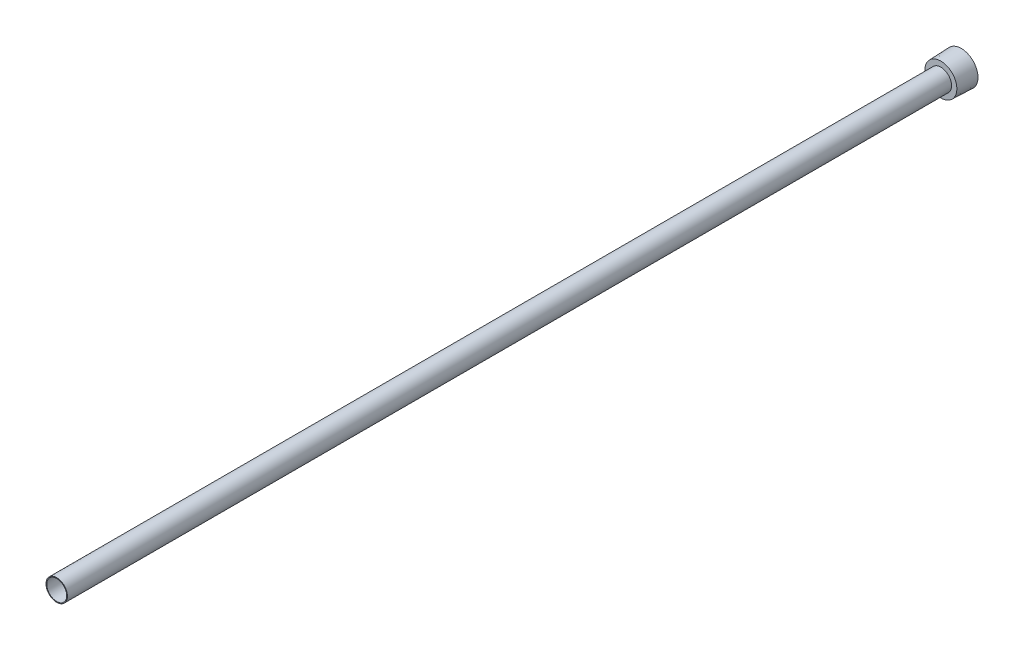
SolidWorks part; units mm, degrees
ref_plane "Front Plane" through (0, 0, 0) normal (0, 0, 1) x (1, 0, 0)
ref_plane "Top Plane" through (0, 0, 0) normal (0, 1, 0) x (1, 0, 0)
ref_plane "Right Plane" through (0, 0, 0) normal (1, 0, 0) x (0, 0, -1)
sketch "Sketch1" plane through (0, 0, 0) normal (1, 0, 0) x (0, 0, -1)
  line L0 (-168.7934, 0) -> (49831.2066, 0) construction
  line L6 (0, 0) -> (0, 8.4709)
  line L7 (0, 8.4709) -> (-10.3124, 8.0947)
  line L8 (-10.3124, 8.0947) -> (-10.3124, 5.4229)
  line L9 (-10.3124, 5.4229) -> (-457.2, 5.4229)
  line L10 (-457.2, 5.4229) -> (-457.2, 0)
  line L11 (0, 0) -> (-457.2, 0)
  dimension "D1" = 10.3124
  dimension "D2" = 16.9418
  dimension "D3" = 2.089
  dimension "D4" = 10.8458
  dimension "D5" = 457.2
revolve "Revolve1" add sketch "Sketch1" angle 360 about L0
sketch "Sketch2" plane through (0, 0, 457.2) normal (0, 0, 1) x (1, 0, 0)
  circle A0 centre (0, 0) radius 5.0419
  dimension "D1" = 10.0838
extrude "Cut-Extrude1" cut sketch "Sketch2" against normal through all
sketch "Sketch3" plane through (0, 0, 0) normal (0, 0, -1) x (-1, 0, 0)
  line L0 (0, 9.318) -> (0, -9.318) construction
  line L1 (0, -6.4158) -> (5.5562, -3.2079)
  line L2 (5.5562, -3.2079) -> (5.5562, 3.2079)
  line L3 (5.5562, 3.2079) -> (0, 6.4158)
  line L4 (0, 6.4158) -> (-5.5563, 3.2079)
  line L5 (-5.5563, 3.2079) -> (-5.5563, -3.2079)
  line L6 (-5.5563, -3.2079) -> (0, -6.4158)
  circle A0 centre (0, 0) radius 5.5563 construction
  dimension "D1" = 11.1125
extrude "Cut-Extrude2" cut sketch "Sketch3" against normal blind 6.35
